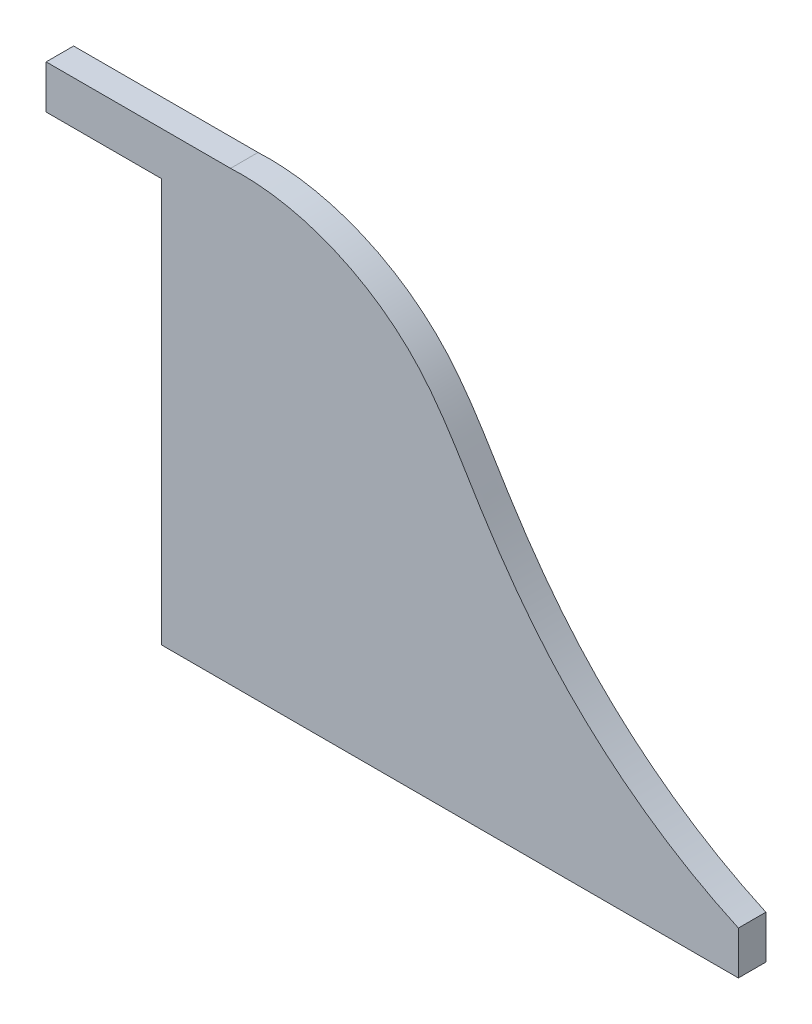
SolidWorks part; units mm, degrees
ref_plane "Front Plane" through (0, 0, 0) normal (0, 0, 1) x (1, 0, 0)
ref_plane "Top Plane" through (0, 0, 0) normal (0, 1, 0) x (1, 0, 0)
ref_plane "Right Plane" through (0, 0, 0) normal (1, 0, 0) x (0, 0, -1)
sketch "Sketch1" plane through (0, 0, 0) normal (0, 0, 1) x (1, 0, 0)
  line L0 (-1218.2656, 213.561) -> (-1218.2656, 353.561)
  line L1 (-1218.2656, 353.561) -> (-1258.2656, 353.561)
  line L2 (-1258.2656, 353.561) -> (-1258.2656, 368.6309)
  line L3 (-1258.2656, 368.6309) -> (-1194.3311, 368.6309)
  line L4 (-1018.2656, 213.561) -> (-1018.2656, 228.561)
  line L8 (-1218.2656, 213.561) -> (-1018.2656, 213.561)
  spline S0 degree 3 poles (-1018.2656, 228.561) (-1042.4615, 239.5478) (-1076.6012, 264.6763) (-1107.9123, 308.825) (-1132.9231, 354.1734) (-1170.6787, 369.8386) (-1194.3311, 368.6309) knots 0 0 0 0 0.342592 0.530418 0.695623 1 1 1 1
extrude "Boss-Extrude1" add sketch "Sketch1" along normal blind 9.525
